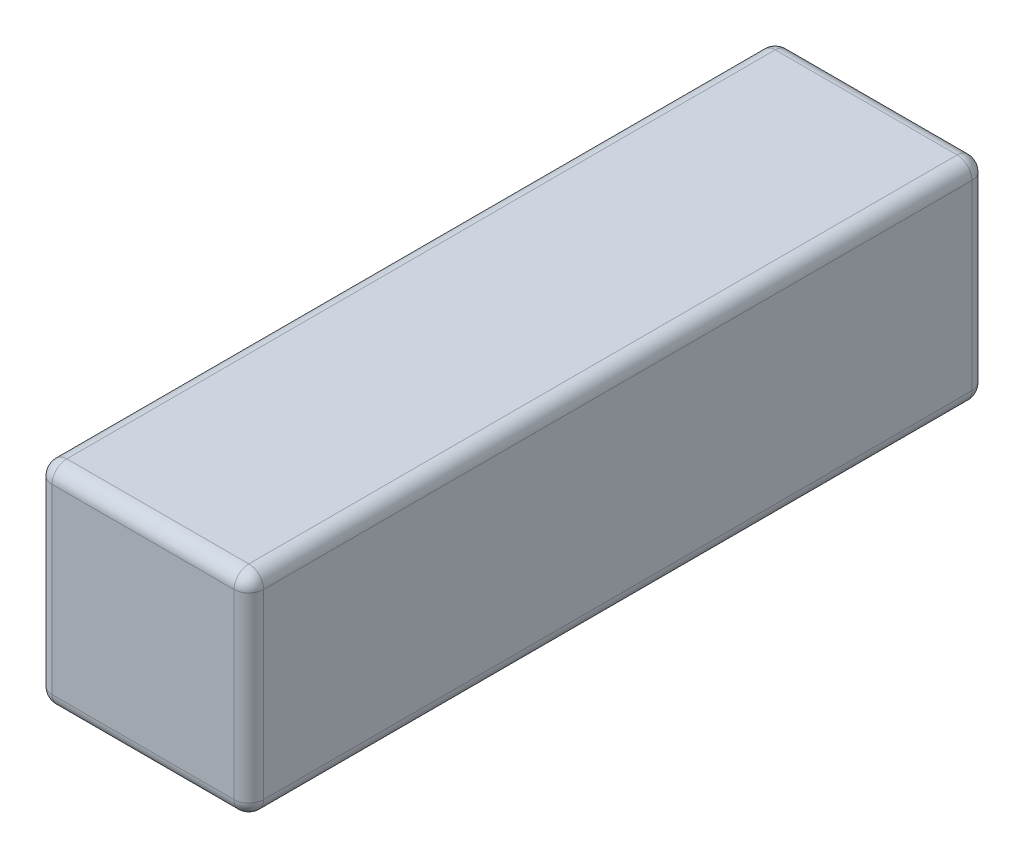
SolidWorks part; units mm, degrees
ref_plane "前视基准面" through (0, 0, 0) normal (0, 0, 1) x (1, 0, 0)
ref_plane "上视基准面" through (0, 0, 0) normal (0, 1, 0) x (1, 0, 0)
ref_plane "右视基准面" through (0, 0, 0) normal (1, 0, 0) x (0, 0, -1)
other "Configuration Table"
sketch "草图1" plane through (0, 0, 0) normal (0, 1, 0) x (1, 0, 0)
  line L1 (-18.5, -75) -> (18.5, -75)
  line L2 (-21.5, -72) -> (-21.5, 72)
  line L3 (-18.5, 75) -> (18.5, 75)
  line L4 (21.5, -72) -> (21.5, 72)
  line L5 (-21.5, -75) -> (21.5, 75) construction
  line L6 (-21.5, 75) -> (21.5, -75) construction
  arc A0 (-21.5, -72) -> (-18.5, -75) centre (-18.5, -72) ccw
  arc A1 (21.5, -72) -> (18.5, -75) centre (18.5, -72) cw
  arc A2 (18.5, 75) -> (21.5, 72) centre (18.5, 72) cw
  arc A3 (-18.5, 75) -> (-21.5, 72) centre (-18.5, 72) ccw
  point P0 (0, 0)
  dimension "D3" = 3
  dimension "D1" = 43
  dimension "D2" = 150
extrude "凸台-拉伸1" add sketch "草图1" along normal mid plane 43
fillet "圆角1" radius 3 16 edges at (20.6213, -21.5, 74.1213) (0, -21.5, 75) (-20.6213, -21.5, 74.1213) (-21.5, -21.5, 0) (-20.6213, -21.5, -74.1213) (0, -21.5, -75) (20.6213, -21.5, -74.1213) (20.6213, 21.5, 74.1213) (0, 21.5, 75) (-20.6213, 21.5, 74.1213) (-21.5, 21.5, 0) (-20.6213, 21.5, -74.1213) (0, 21.5, -75) (20.6213, 21.5, -74.1213) (21.5, -21.5, 0) (21.5, 21.5, 0)
